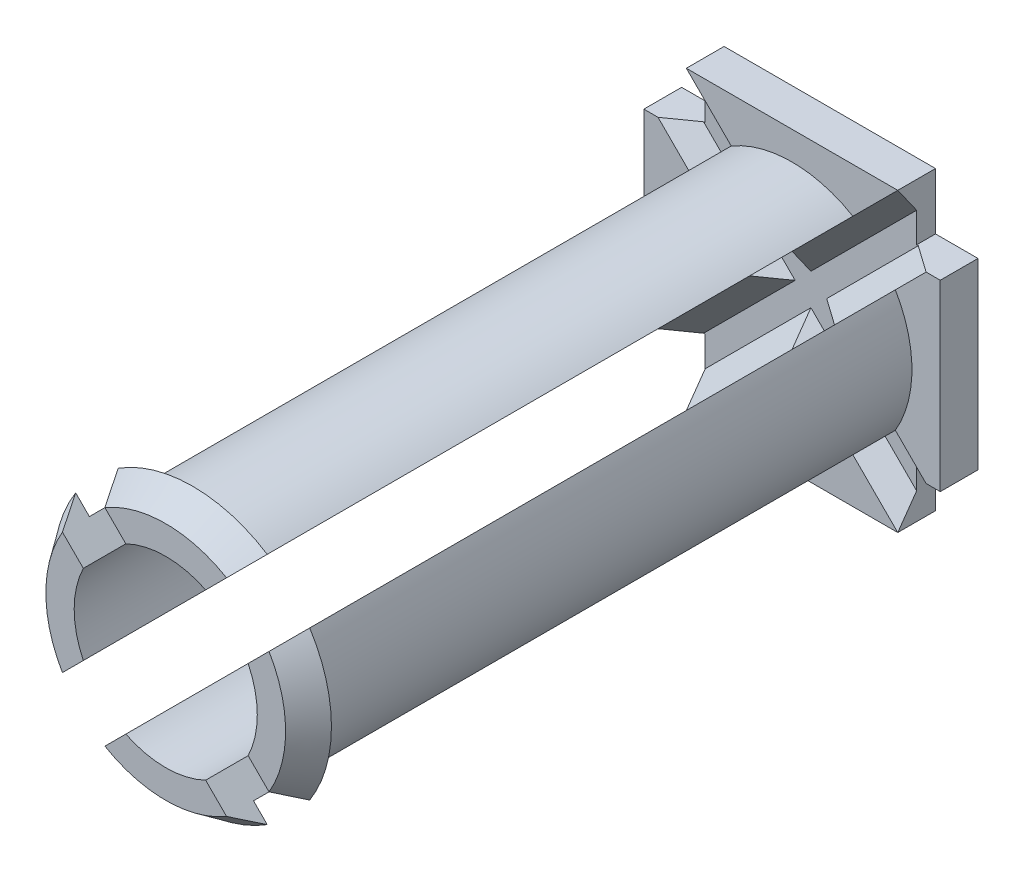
SolidWorks part; units mm, degrees
ref_plane "Front Plane" through (0, 0, 0) normal (0, 0, 1) x (1, 0, 0)
ref_plane "Top Plane" through (0, 0, 0) normal (0, 1, 0) x (1, 0, 0)
ref_plane "Right Plane" through (0, 0, 0) normal (1, 0, 0) x (0, 0, -1)
sketch "Sketch6" plane through (0, 0, 0) normal (0, 0, 1) x (1, 0, 0)
  line L0 (0, 0) -> (0, 50000) construction
  line L1 (-13.7, 15.7) -> (13.7, 15.7)
  line L2 (-15.7, 13.7) -> (-15.7, -13.7)
  line L3 (-13.7, -15.7) -> (13.7, -15.7)
  line L4 (15.7, 13.7) -> (15.7, -13.7)
  line L5 (0, 0) -> (50000, 0) construction
  arc A0 (-15.7, -13.7) -> (-13.7, -15.7) centre (-13.7, -13.7) ccw
  arc A1 (13.7, -15.7) -> (15.7, -13.7) centre (13.7, -13.7) ccw
  arc A2 (13.7, 15.7) -> (15.7, 13.7) centre (13.7, 13.7) cw
  arc A3 (-13.7, 15.7) -> (-15.7, 13.7) centre (-13.7, 13.7) ccw
  dimension "D5" = 2
  dimension "D1" = 15.7
  dimension "D2" = 15.7
  dimension "D3" = 15.7
  dimension "D4" = 15.7
extrude "Boss-Extrude4" add sketch "Sketch6" along normal mid plane 4
sketch "Sketch2" plane through (0, 0, 0) normal (1, 0, 0) x (0, 0, -1)
  line L0 (0, 0) -> (-50000, 0) construction
  line L1 (-2, 9.7) -> (-68.3563, 9.7)
  line L3 (-68.3563, 9.7) -> (-68.3563, 12.7)
  line L4 (-68.3563, 12.7) -> (-65.5, 14.7)
  line L5 (-65.5, 14.7) -> (-65.5, 12.7)
  line L6 (-65.5, 12.7) -> (-2, 12.7)
  line L7 (-2, 12.7) -> (-2, 9.7)
  line L9 (0, 0) -> (0, 50000) construction
  dimension "D1" = 12.7
  dimension "D2" = 3
  dimension "D3" = 35
  dimension "D4" = 2
  dimension "D5" = 63.5
  dimension "D6" = 2
revolve "Revolve1" add sketch "Sketch2" angle 360 about L0
ref_plane "Plane1" through (-12.7, 0, 0) normal (1, 0, 0) x (0, 0, -1)
sketch "Sketch5" plane through (0, 0, 0) normal (0, 0, 1) x (1, 0, 0)
  line L0 (0, 0) -> (-50000, 0) construction
  line L1 (-13.7, 15.7) -> (-11.2, 15.7)
  line L2 (-15.7, 13.7) -> (-15.7, 9.7)
  line L3 (-13.7, -15.7) -> (-11.2, -15.7)
  line L4 (15.7, 13.7) -> (15.7, 9.7)
  line L5 (0, 0) -> (0, 50000) construction
  line L6 (-4.5, 0) -> (-14.2, -9.7)
  line L7 (0, -4.5) -> (11.2, -15.7)
  line L9 (0, -4.5) -> (-11.2, -15.7)
  line L10 (4.5, 0) -> (14.2, -9.7)
  line L19 (-11.2, 15.7) -> (0, 4.5)
  line L20 (-14.2, 9.7) -> (-4.5, 0)
  line L21 (11.2, 15.7) -> (0, 4.5)
  line L22 (14.2, 9.7) -> (4.5, 0)
  line L23 (-14.2, 9.7) -> (-15.7, 9.7)
  line L24 (14.2, 9.7) -> (15.7, 9.7)
  line L25 (-14.2, -9.7) -> (-15.7, -9.7)
  line L26 (14.2, -9.7) -> (15.7, -9.7)
  line L27 (11.2, 15.7) -> (13.7, 15.7)
  line L28 (15.7, -9.7) -> (15.7, -13.7)
  line L29 (11.2, -15.7) -> (13.7, -15.7)
  line L30 (-15.7, -9.7) -> (-15.7, -13.7)
  arc A0 (13.7, 15.7) -> (15.7, 13.7) centre (13.7, 13.7) cw
  arc A1 (13.7, -15.7) -> (15.7, -13.7) centre (13.7, -13.7) ccw
  arc A2 (-15.7, -13.7) -> (-13.7, -15.7) centre (-13.7, -13.7) ccw
  arc A3 (-13.7, 15.7) -> (-15.7, 13.7) centre (-13.7, 13.7) ccw
  dimension "D5" = 2
  dimension "D1" = 15.7
  dimension "D2" = 15.7
  dimension "D3" = 15.7
  dimension "D4" = 15.7
extrude "Cut-Extrude1" cut sketch "Sketch5" along normal through all
sketch "Sketch7" plane through (0, 0, 0) normal (0, 0, 1) x (1, 0, 0)
  line L0 (-15.7, 9.7) -> (-11.2, 9.7)
  line L1 (-11.2, 15.7) -> (-11.2, 9.7)
  line L2 (-11.2, 15.7) -> (-15.7, 15.7)
  line L3 (-15.7, 15.7) -> (-15.7, 9.7)
  line L4 (11.2, 15.7) -> (11.2, 9.7)
  line L5 (11.2, 9.7) -> (15.7, 9.7)
  line L6 (15.7, 9.7) -> (15.7, 15.7)
  line L7 (15.7, 15.7) -> (11.2, 15.7)
  line L8 (-11.2, -15.7) -> (-11.2, -9.7)
  line L9 (-11.2, -9.7) -> (-15.7, -9.7)
  line L10 (-15.7, -9.7) -> (-15.7, -15.7)
  line L11 (-15.7, -15.7) -> (-11.2, -15.7)
  line L12 (11.2, -15.7) -> (11.2, -9.7)
  line L13 (11.2, -9.7) -> (15.7, -9.7)
  line L14 (15.7, -9.7) -> (15.7, -15.7)
  line L15 (15.7, -15.7) -> (11.2, -15.7)
extrude "Cut-Extrude2" cut sketch "Sketch7" against normal through all
chamfer "Chamfer1" distance 2 angle 45 8 edges at (-5.6, -10.1, 0) (5.6, -10.1, 0) (9.35, -4.85, 0) (9.35, 4.85, 0) (-9.35, -4.85, 0) (-9.35, 4.85, 0) (5.6, 10.1, 0) (-5.6, 10.1, 0)
